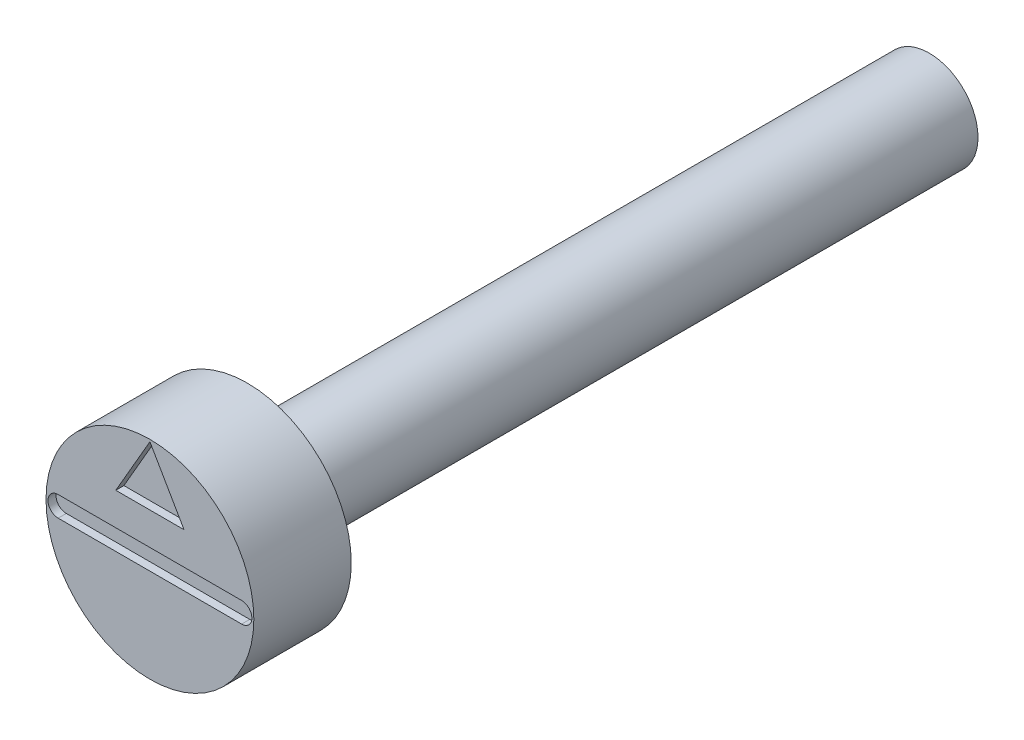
SolidWorks part; units mm, degrees
ref_plane "Front Plane" through (0, 0, 0) normal (0, 0, 1) x (1, 0, 0)
ref_plane "Top Plane" through (0, 0, 0) normal (0, 1, 0) x (1, 0, 0)
ref_plane "Right Plane" through (0, 0, 0) normal (1, 0, 0) x (0, 0, -1)
imported_body "Imported1"
sketch "Sketch2" plane through (0, 0, 0) normal (0, 1, 0) x (1, 0, 0)
  line L0 (1.75, 24) -> (-1.75, 24) construction
  line L1 (1.5, 24) -> (1.75, 24)
  line L2 (1.5, 24) -> (1.5, 3)
  line L3 (1.5, 3) -> (1.75, 3)
  line L4 (1.75, 24) -> (1.75, 3)
  line L5 (3.2, 3) -> (-3.2, 3) construction
  line L6 (1.75, 3) -> (1.75, 24) construction
  line L7 (0, 24) -> (0, 26.7548) construction
  dimension "D1" = 3
revolve "Cut-Revolve1" cut sketch "Sketch2" angle 360 about L7
other "DeleteFace1"
sketch "Sketch1" plane through (0, 0, 0) normal (0, 0, 1) x (1, 0, 0)
  line L0 (0, 3.135) -> (-1.0508, 1.315)
  line L1 (-1.0508, 1.315) -> (1.0508, 1.315)
  line L2 (1.0508, 1.315) -> (0, 3.135)
  line L4 (-2.825, 0.315) -> (2.825, 0.315)
  line L6 (-2.825, -0.315) -> (2.825, -0.315)
  arc A0 (-2.825, 0.315) -> (-2.825, -0.315) centre (-2.825, 0) ccw
  arc A1 (2.825, -0.315) -> (2.825, 0.315) centre (2.825, 0) ccw
  dimension "D5" = 6.28
  dimension "D6" = 3.14
  dimension "D1" = 1.82
  dimension "D2" = 60
  dimension "D3" = 60
  dimension "D4" = 0.63
  dimension "D7" = 0.315
  dimension "D8" = 1
extrude "Cut-Extrude1" cut sketch "Sketch1" against normal blind 0.25
